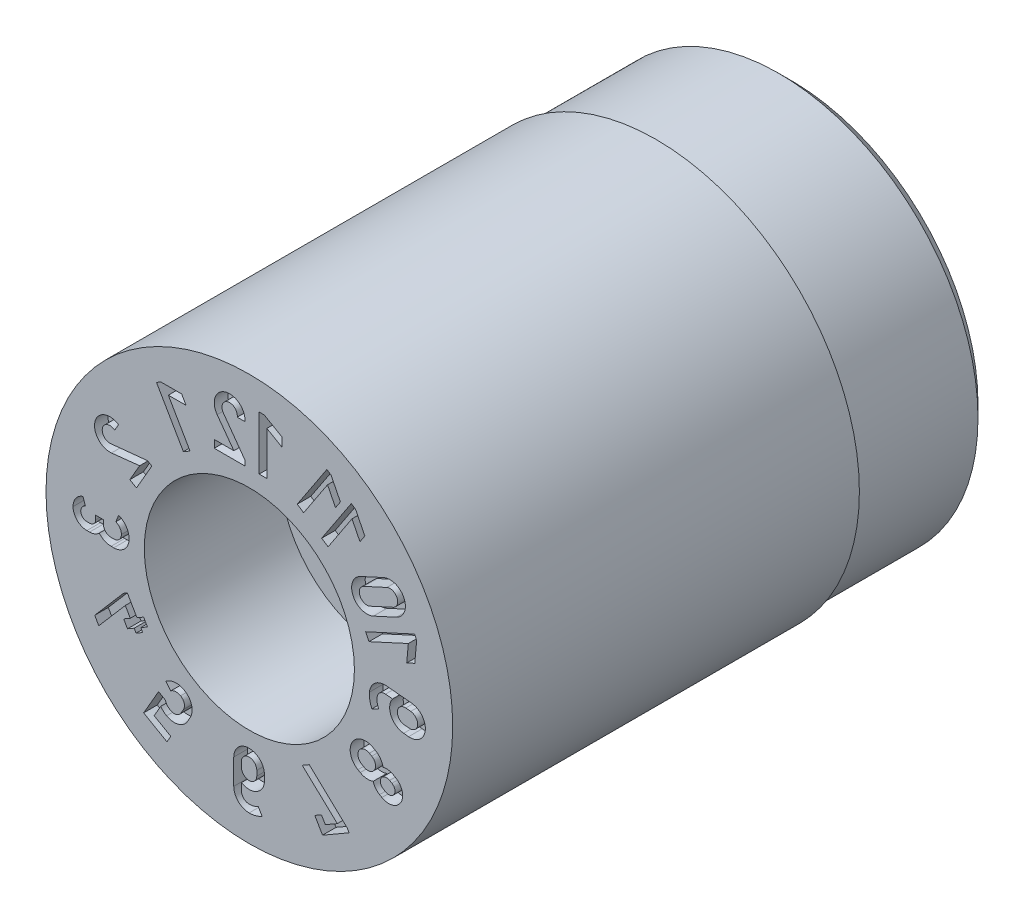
SolidWorks part; units mm, degrees
ref_plane "Front Plane" through (0, 0, 0) normal (0, 0, 1) x (1, 0, 0)
ref_plane "Top Plane" through (0, 0, 0) normal (0, 1, 0) x (1, 0, 0)
ref_plane "Right Plane" through (0, 0, 0) normal (1, 0, 0) x (0, 0, -1)
sketch "Sketch1" plane through (0, 0, 0) normal (1, 0, 0) x (0, 0, -1)
  line L2 (0, 3) -> (0, 1.55)
  line L3 (7.75, 3) -> (0, 3)
  line L4 (-3.7979, 0) -> (49996.2021, 0) construction
  line L8 (8, 0.8) -> (2, 0.8)
  line L9 (2, 1.55) -> (2, 0.8)
  line L10 (2, 1.55) -> (0, 1.55)
  line L12 (8, 0.8) -> (8, 2.75)
  line L16 (8, 2.75) -> (7.75, 3)
  dimension "D1" = 8
  dimension "D2" = 45
  dimension "D3" = 0.25
  dimension "D4" = 6
  dimension "D5" = 3.1
  dimension "D6" = 2
  dimension "D7" = 1.6
revolve "Revolve1" add sketch "Sketch1" angle 360 about L4
sketch "Sketch4" plane through (0, 0, 0) normal (1, 0, 0) x (0, 0, -1)
  line L0 (0, 0) -> (50000, 0) construction
  line L1 (8, -2.75) -> (8, 2.75) construction
  line L2 (6, 3.935) -> (8, 3.935)
  line L3 (6, 3.935) -> (6, 2.935)
  line L4 (6, 2.935) -> (8, 2.935)
  line L5 (8, 3.935) -> (8, 2.935)
  line L6 (7.75, 3) -> (0, 3) construction
  line L9 (0, 55) -> (0, -55) construction
  dimension "D1" = 1
  dimension "D2" = 0.065
  dimension "D3" = 6
revolve "Cut-Revolve1" cut sketch "Sketch4" angle 360 about L0
sketch "Sketch2" plane through (0, 0, 0) normal (0, 0, 1) x (1, 0, 0)
  line L230 (1.5045, 2.0997) -> (1.5668, 2.0585)
  line L231 (1.5668, 2.0585) -> (1.704, 1.7849)
  line L232 (1.704, 1.7849) -> (1.6319, 1.6759)
  line L233 (1.6319, 1.6759) -> (1.5147, 1.9096)
  line L234 (1.5147, 1.9096) -> (1.1617, 1.3755)
  line L235 (1.1617, 1.3755) -> (1.0672, 1.4379)
  line L236 (1.0672, 1.4379) -> (1.5045, 2.0997)
  line L237 (1.1437, 2.3542) -> (1.2059, 2.313)
  line L238 (1.2059, 2.313) -> (1.3432, 2.0395)
  line L239 (1.3432, 2.0395) -> (1.2711, 1.9304)
  line L240 (1.2711, 1.9304) -> (1.1539, 2.1641)
  line L241 (1.1539, 2.1641) -> (0.8009, 1.63)
  line L242 (0.8009, 1.63) -> (0.7064, 1.6925)
  line L243 (0.7064, 1.6925) -> (1.1437, 2.3542)
  line L244 (1.783, 0.9273) -> (2.1228, 1.0834)
  line L245 (2.0282, 1.2894) -> (1.6884, 1.1333)
  line L246 (2.381, -0.118) -> (2.3076, -0.1111)
  line L247 (2.2866, -0.3368) -> (2.3599, -0.3436)
  line L248 (2.3915, -0.0051) -> (2.0192, 0.0296)
  line L249 (1.8078, -0.3718) -> (1.9101, -0.3226)
  line L250 (2.3492, -0.4564) -> (2.276, -0.4498)
  line L251 (2.1122, -0.0929) -> (2.0086, -0.0833)
  line L252 (1.9784, -1.3122) -> (2.0128, -1.332)
  line L253 (2.1034, -1.175) -> (2.0691, -1.1552)
  line L254 (0.7808, -1.6066) -> (0.8832, -1.5474)
  line L255 (0.8832, -1.5474) -> (1.4446, -2.0764)
  line L256 (1.4446, -2.0764) -> (1.4718, -2.1235)
  line L257 (1.4718, -2.1235) -> (1.0793, -2.3502)
  line L258 (1.0793, -2.3502) -> (0.9659, -2.1539)
  line L259 (0.9659, -2.1539) -> (1.0641, -2.0972)
  line L260 (1.0641, -2.0972) -> (1.1207, -2.1953)
  line L261 (1.1207, -2.1953) -> (1.2974, -2.0934)
  line L262 (1.2974, -2.0934) -> (0.7808, -1.6066)
  line L263 (1.658, -1.1534) -> (1.6923, -1.1732)
  line L264 (1.8056, -0.9769) -> (1.7713, -0.9571)
  line L265 (1.8623, -0.8788) -> (1.828, -0.8589)
  line L266 (1.6013, -1.2515) -> (1.6357, -1.2713)
  line L267 (1.9218, -1.4104) -> (1.9561, -1.4302)
  line L268 (2.16, -1.077) -> (2.1257, -1.057)
  line L269 (2.4374, 0.8988) -> (2.4685, 0.831)
  line L270 (2.4685, 0.831) -> (2.4406, 0.5262)
  line L271 (2.4406, 0.5262) -> (2.3218, 0.4717)
  line L272 (2.3218, 0.4717) -> (2.3456, 0.732)
  line L273 (2.3456, 0.732) -> (1.7639, 0.4648)
  line L274 (1.7639, 0.4648) -> (1.7166, 0.5677)
  line L275 (1.7166, 0.5677) -> (2.4374, 0.8988)
  line L276 (1.9809, 1.3924) -> (1.6411, 1.2363)
  line L277 (1.8303, 0.8243) -> (2.1701, 0.9804)
  line L278 (0.1451, 2.5897) -> (0.2196, 2.5897)
  line L279 (0.2196, 2.5897) -> (0.485, 2.4371)
  line L280 (0.485, 2.4371) -> (0.485, 2.3064)
  line L281 (0.485, 2.3064) -> (0.2584, 2.4367)
  line L282 (0.2584, 2.4367) -> (0.2584, 1.7965)
  line L283 (0.2584, 1.7965) -> (0.1451, 1.7965)
  line L284 (0.1451, 1.7965) -> (0.1451, 2.5897)
  line L285 (-0.5174, 1.7947) -> (-0.0642, 1.7947)
  line L286 (-0.0642, 1.7947) -> (-0.0642, 1.8697)
  line L287 (-0.0642, 1.8697) -> (-0.3828, 2.3121)
  line L288 (-0.1788, 2.3613) -> (-0.0648, 2.3613)
  line L289 (-0.4749, 2.2457) -> (-0.2285, 1.9081)
  line L290 (-0.2285, 1.9081) -> (-0.5174, 1.9081)
  line L291 (-0.5174, 1.9081) -> (-0.5174, 1.7947)
  line L292 (-1.3697, 2.2106) -> (-1.3051, 2.2479)
  line L293 (-1.3051, 2.2479) -> (-0.9991, 2.2484)
  line L294 (-0.9991, 2.2484) -> (-0.9337, 2.1352)
  line L295 (-0.9337, 2.1352) -> (-1.1951, 2.1347)
  line L296 (-1.1951, 2.1347) -> (-0.875, 1.5803)
  line L297 (-0.875, 1.5803) -> (-0.9731, 1.5236)
  line L298 (-0.9731, 1.5236) -> (-1.3697, 2.2106)
  line L299 (-0.1169, -2.0067) -> (-0.1169, -2.0803)
  line L300 (0.1097, -2.0803) -> (0.1097, -2.0067)
  line L301 (0.223, -2.0068) -> (0.2233, -2.0803)
  line L302 (-0.1169, -2.2766) -> (-0.1169, -2.3806)
  line L303 (-0.2303, -2.0067) -> (-0.2302, -2.3806)
  line L304 (0.1891, -2.5538) -> (0.1306, -2.4565)
  line L305 (-1.3075, -1.8973) -> (-1.4043, -2.0649)
  line L306 (-1.4043, -2.0649) -> (-1.159, -2.2066)
  line L307 (-1.159, -2.2066) -> (-1.2156, -2.3047)
  line L308 (-1.2156, -2.3047) -> (-1.5591, -2.1064)
  line L309 (-1.5591, -2.1064) -> (-1.3392, -1.7255)
  line L310 (-1.3392, -1.7255) -> (-1.241, -1.7821)
  line L311 (-1.0098, -1.8348) -> (-0.9729, -1.771)
  line L312 (-1.1606, -1.6271) -> (-1.2312, -1.5383)
  line L313 (-0.8748, -1.8277) -> (-0.9117, -1.8914)
  line L314 (-2.0005, -0.105) -> (-2.0402, -0.105)
  line L315 (-2.1535, 0.0083) -> (-2.1535, 0.0649)
  line L316 (-2.1535, 0.0649) -> (-2.2668, 0.0649)
  line L317 (-2.2668, 0.0649) -> (-2.2668, 0.0083)
  line L318 (-2.3574, -0.0824) -> (-2.3971, -0.0824)
  line L319 (-2.4184, 0.1049) -> (-2.4547, 0.2122)
  line L320 (-2.3971, -0.1957) -> (-2.3574, -0.1957)
  line L321 (-2.0402, -0.2184) -> (-2.0005, -0.2184)
  line L322 (-1.9281, 0.2349) -> (-1.9697, 0.1295)
  line L323 (-2.281, -1.2206) -> (-2.221, -1.3245)
  line L324 (-2.221, -1.3245) -> (-1.8295, -0.8695)
  line L325 (-1.8295, -0.8695) -> (-1.7561, -0.9967)
  line L326 (-1.7561, -0.9967) -> (-1.8542, -1.0533)
  line L327 (-1.8542, -1.0533) -> (-1.7975, -1.1514)
  line L328 (-1.7975, -1.1514) -> (-1.6994, -1.0948)
  line L329 (-1.6994, -1.0948) -> (-1.6711, -1.1439)
  line L330 (-1.6711, -1.1439) -> (-1.573, -1.0872)
  line L331 (-1.573, -1.0872) -> (-1.6013, -1.0381)
  line L332 (-1.6013, -1.0381) -> (-1.5032, -0.9815)
  line L333 (-1.5032, -0.9815) -> (-1.5598, -0.8834)
  line L334 (-1.5598, -0.8834) -> (-1.658, -0.94)
  line L335 (-1.658, -0.94) -> (-1.7996, -0.6947)
  line L336 (-1.7996, -0.6947) -> (-1.857, -0.7278)
  line L337 (-1.857, -0.7278) -> (-2.281, -1.2206)
  line L338 (-1.7633, 0.7709) -> (-1.6651, 0.7143)
  line L339 (-1.6651, 0.7143) -> (-1.4385, 1.1068)
  line L340 (-1.4385, 1.1068) -> (-1.5034, 1.1443)
  line L341 (-1.5034, 1.1443) -> (-2.0458, 1.0895)
  line L342 (-1.9864, 1.2908) -> (-1.9295, 1.3895)
  line L343 (-2.0344, 0.9766) -> (-1.6188, 1.0212)
  line L344 (-1.6188, 1.0212) -> (-1.7633, 0.7709)
  arc A108 (1.6884, 1.1333) -> (1.783, 0.9273) centre (1.7357, 1.0303) ccw
  arc A109 (2.1228, 1.0834) -> (2.0282, 1.2894) centre (2.0755, 1.1864) ccw
  arc A110 (2.3076, -0.1111) -> (2.2866, -0.3368) centre (2.2971, -0.224) ccw
  arc A111 (2.3599, -0.3436) -> (2.381, -0.118) centre (2.3704, -0.2308) ccw
  arc A112 (2.0192, 0.0296) -> (1.7725, -0.175) centre (1.9981, -0.1961) ccw
  arc A113 (1.7725, -0.175) -> (1.8078, -0.3718) centre (2.1445, -0.2098) ccw
  arc A114 (2.3492, -0.4564) -> (2.3915, -0.0051) centre (2.3704, -0.2308) ccw
  arc A115 (2.1122, -0.0929) -> (2.276, -0.4498) centre (2.2963, -0.2245) ccw
  arc A116 (2.0086, -0.0833) -> (1.8864, -0.1769) centre (1.9981, -0.196) ccw
  arc A117 (1.8864, -0.1769) -> (1.9101, -0.3226) centre (2.1106, -0.2153) ccw
  arc A118 (2.0691, -1.1552) -> (1.9784, -1.3122) centre (2.0236, -1.2336) ccw
  arc A119 (2.0128, -1.332) -> (2.1034, -1.175) centre (2.0581, -1.2535) ccw
  arc A120 (1.7713, -0.9571) -> (1.658, -1.1534) centre (1.7147, -1.0552) ccw
  arc A121 (1.6923, -1.1732) -> (1.8056, -0.9769) centre (1.749, -1.0751) ccw
  arc A122 (1.9723, -1.0363) -> (1.8623, -0.8788) centre (1.749, -1.0751) ccw
  arc A123 (1.828, -0.8589) -> (1.6013, -1.2515) centre (1.7145, -1.0551) ccw
  arc A124 (1.6357, -1.2713) -> (1.8271, -1.2878) centre (1.749, -1.0751) ccw
  arc A125 (1.8271, -1.2878) -> (1.9218, -1.4104) centre (2.024, -1.2336) ccw
  arc A126 (1.9561, -1.4302) -> (2.16, -1.077) centre (2.0581, -1.2536) ccw
  arc A127 (2.1257, -1.057) -> (1.9723, -1.0363) centre (2.024, -1.232) ccw
  arc A128 (1.6411, 1.2363) -> (1.8303, 0.8243) centre (1.7357, 1.0303) ccw
  arc A129 (2.1701, 0.9804) -> (1.9809, 1.3924) centre (2.0755, 1.1864) ccw
  arc A130 (-0.1788, 2.3613) -> (-0.3828, 2.3121) centre (-0.2908, 2.3783) ccw
  arc A131 (-0.0648, 2.3613) -> (-0.4749, 2.2457) centre (-0.2909, 2.3782) ccw
  arc A132 (-0.1169, -2.0803) -> (0.1097, -2.0803) centre (-0.0036, -2.0803) ccw
  arc A133 (0.1097, -2.0067) -> (-0.1169, -2.0067) centre (-0.0036, -2.0067) ccw
  arc A134 (0.223, -2.0068) -> (-0.2303, -2.0067) centre (-0.0036, -2.0067) ccw
  arc A135 (-0.1169, -2.2766) -> (0.2233, -2.0803) centre (-0.003, -2.0811) ccw
  arc A136 (-0.1169, -2.3806) -> (-0.0123, -2.4936) centre (-0.0036, -2.3806) ccw
  arc A137 (-0.0123, -2.4936) -> (0.1306, -2.4565) centre (0.0051, -2.2668) ccw
  arc A138 (-0.2302, -2.3806) -> (-0.0036, -2.6072) centre (-0.0035, -2.3806) ccw
  arc A139 (-0.0036, -2.6072) -> (0.1891, -2.5538) centre (-0.0035, -2.2336) ccw
  arc A140 (-1.241, -1.7821) -> (-1.1645, -1.8763) centre (-1.0794, -1.729) ccw
  arc A141 (-1.1645, -1.8763) -> (-1.0098, -1.8348) centre (-1.1079, -1.7782) ccw
  arc A142 (-0.9729, -1.771) -> (-1.0144, -1.6162) centre (-1.071, -1.7143) ccw
  arc A143 (-1.0144, -1.6162) -> (-1.1606, -1.6271) centre (-1.0795, -1.7292) ccw
  arc A144 (-0.9578, -1.5181) -> (-1.2312, -1.5383) centre (-1.0796, -1.7289) ccw
  arc A145 (-0.8748, -1.8277) -> (-0.9578, -1.5181) centre (-1.0713, -1.7144) ccw
  arc A146 (-1.2212, -1.9744) -> (-0.9117, -1.8914) centre (-1.1081, -1.7776) ccw
  arc A147 (-1.3075, -1.8973) -> (-1.2212, -1.9744) centre (-1.0812, -1.7309) ccw
  arc A148 (-1.8872, 0.0083) -> (-1.9697, 0.1295) centre (-2.0175, 0.0083) ccw
  arc A149 (-2.0005, -0.105) -> (-1.8872, 0.0083) centre (-2.0005, 0.0083) ccw
  arc A150 (-2.1535, 0.0083) -> (-2.0402, -0.105) centre (-2.0402, 0.0083) ccw
  arc A151 (-2.3574, -0.0824) -> (-2.2668, 0.0083) centre (-2.3574, 0.0083) ccw
  arc A152 (-2.4877, 0.0083) -> (-2.3971, -0.0824) centre (-2.397, 0.0084) ccw
  arc A153 (-2.4184, 0.1049) -> (-2.4877, 0.0083) centre (-2.3859, 0.0084) ccw
  arc A154 (-2.4547, 0.2122) -> (-2.601, 0.0083) centre (-2.3857, 0.0082) ccw
  arc A155 (-2.601, 0.0083) -> (-2.3971, -0.1957) centre (-2.3971, 0.0082) ccw
  arc A156 (-2.3574, -0.1957) -> (-2.2142, -0.1369) centre (-2.3574, 0.0082) ccw
  arc A157 (-2.2142, -0.1369) -> (-2.0402, -0.2184) centre (-2.0402, 0.0082) ccw
  arc A158 (-2.0005, -0.2184) -> (-1.7739, 0.0083) centre (-2.0005, 0.0082) ccw
  arc A159 (-1.7739, 0.0083) -> (-1.9281, 0.2349) centre (-2.0176, 0.0082) ccw
  arc A160 (-1.9864, 1.2908) -> (-2.0458, 1.0895) centre (-2.0572, 1.2023) ccw
  arc A161 (-1.9295, 1.3895) -> (-2.0344, 0.9766) centre (-2.0571, 1.2022) ccw
  point P446 (0, 0.0044)
  point P447 (0.0044, 0.0044)
  point P448 (0.0044, 0)
extrude "Cut-Extrude1" cut sketch "Sketch2" against normal blind 0.2
